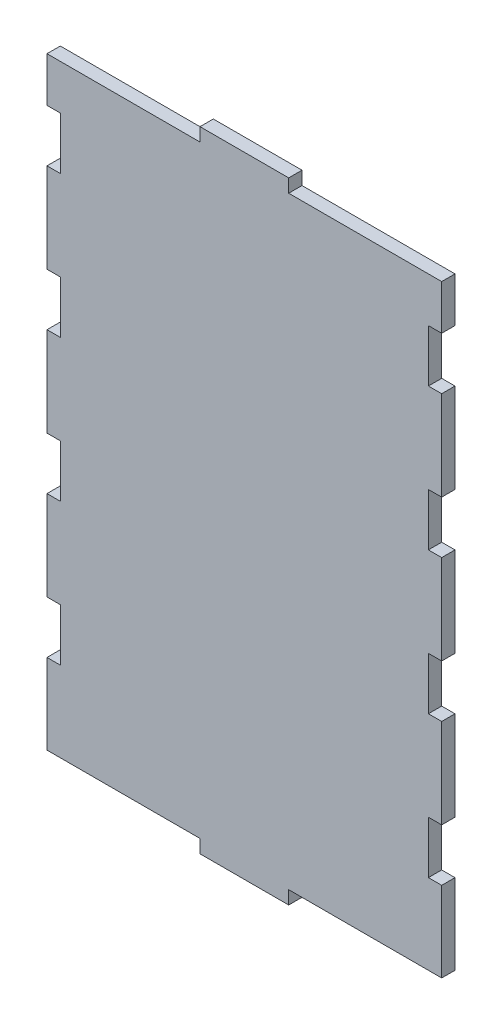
SolidWorks part; units mm, degrees
ref_plane "Alzado" through (0, 0, 0) normal (0, 0, 1) x (1, 0, 0)
ref_plane "Planta" through (0, 0, 0) normal (0, 1, 0) x (1, 0, 0)
ref_plane "Vista lateral" through (0, 0, 0) normal (1, 0, 0) x (0, 0, -1)
sketch "Croquis1" plane through (0, 0, 0) normal (0, 0, 1) x (1, 0, 0)
  line L1 (222.5, -355) -> (-222.5, -355)
  line L2 (222.5, -355) -> (222.5, 355)
  line L3 (222.5, 355) -> (-222.5, 355)
  line L4 (-222.5, -355) -> (-222.5, 355)
  line L5 (222.5, -355) -> (-222.5, 355) construction
  line L6 (222.5, 355) -> (-222.5, -355) construction
  point P0 (0, 0)
extrude "Saliente-Extruir1" add sketch "Croquis1" along normal blind 15
sketch "Croquis2" plane through (0, 0, 15) normal (0, 0, 1) x (1, 0, 0)
  line L0 (-222.5, -355) -> (-222.5, -340)
  line L1 (-222.5, 355) -> (-222.5, -355) construction
  line L2 (-222.5, -340) -> (-50, -340)
  line L3 (-50, -340) -> (-50, -355)
  line L4 (-222.5, -355) -> (222.5, -355) construction
  line L5 (-50, -355) -> (-222.5, -355)
  line L6 (50, -355) -> (50, -340)
  line L7 (50, -340) -> (222.5, -340)
  line L8 (222.5, -355) -> (222.5, 355) construction
  line L9 (222.5, -340) -> (222.5, -355)
  line L10 (222.5, -355) -> (50, -355)
  line L11 (0, 0) -> (222.5, 0) construction
  line L12 (222.5, 355) -> (50, 355)
  line L13 (222.5, 340) -> (222.5, 355)
  line L14 (50, 340) -> (222.5, 340)
  line L15 (50, 355) -> (50, 340)
  line L16 (-50, 355) -> (-222.5, 355)
  line L17 (-50, 340) -> (-50, 355)
  line L18 (-222.5, 340) -> (-50, 340)
  line L19 (-222.5, 355) -> (-222.5, 340)
extrude "Cortar-Extruir1" cut sketch "Croquis2" against normal through all
sketch "Croquis4" plane through (0, 0, 15) normal (0, 0, 1) x (1, 0, 0)
  line L0 (-222.5, -249.5) -> (-222.5, -190.5)
  line L1 (-222.5, -249.5) -> (-207.5, -249.5)
  line L2 (-222.5, -249.5) -> (-222.5, -350.5) construction
  line L5 (-207.5, 289.5) -> (-207.5, 230.5)
  line L6 (-222.5, -89.5) -> (-207.5, -89.5)
  line L7 (-222.5, -89.5) -> (-222.5, -190.5) construction
  line L8 (-222.5, -190.5) -> (-207.5, -190.5)
  line L9 (222.5, 289.5) -> (222.5, 390.5) construction
  line L10 (-207.5, 129.5) -> (-207.5, 70.5)
  line L11 (-222.5, 70.5) -> (-207.5, 70.5)
  line L12 (-222.5, 70.5) -> (-222.5, -30.5) construction
  line L13 (-222.5, -30.5) -> (-207.5, -30.5)
  line L14 (222.5, 70.5) -> (222.5, -30.5) construction
  line L15 (-222.5, 289.5) -> (-222.5, 230.5)
  line L16 (-222.5, -89.5) -> (-222.5, -30.5)
  line L17 (-222.5, 129.5) -> (-222.5, 70.5)
  line L18 (-222.5, 230.5) -> (-207.5, 230.5)
  line L19 (-222.5, 230.5) -> (-222.5, 129.5)
  line L20 (-222.5, 129.5) -> (-207.5, 129.5)
  line L21 (222.5, -89.5) -> (222.5, -190.5) construction
  line L22 (-207.5, -30.5) -> (-207.5, -89.5)
  line L23 (-222.5, 289.5) -> (-207.5, 289.5)
  line L24 (-222.5, 289.5) -> (-222.5, 390.5) construction
  line L26 (222.5, -350.5) -> (207.5, -350.5) construction
  line L27 (0, 355) -> (0, -355) construction
  line L28 (-207.5, -190.5) -> (-207.5, -249.5)
  line L29 (50, 355) -> (-50, 355) construction
  line L30 (222.5, -249.5) -> (222.5, -350.5) construction
  line L31 (207.5, -190.5) -> (207.5, -249.5)
  line L32 (222.5, 289.5) -> (207.5, 289.5)
  line L33 (207.5, -30.5) -> (207.5, -89.5)
  line L34 (222.5, 129.5) -> (207.5, 129.5)
  line L35 (222.5, 230.5) -> (222.5, 129.5)
  line L36 (222.5, 230.5) -> (207.5, 230.5)
  line L37 (222.5, 129.5) -> (222.5, 70.5)
  line L38 (222.5, -89.5) -> (222.5, -30.5)
  line L39 (222.5, 289.5) -> (222.5, 230.5)
  line L40 (222.5, -30.5) -> (207.5, -30.5)
  line L41 (222.5, 70.5) -> (207.5, 70.5)
  line L42 (207.5, 129.5) -> (207.5, 70.5)
  line L43 (222.5, -190.5) -> (207.5, -190.5)
  line L44 (222.5, -89.5) -> (207.5, -89.5)
  line L45 (207.5, 289.5) -> (207.5, 230.5)
  line L46 (222.5, -249.5) -> (207.5, -249.5)
  line L47 (222.5, -249.5) -> (222.5, -190.5)
  point P10 (0, 0)
  point P21 (-222.5, 340)
extrude "Cortar-Extruir2" cut sketch "Croquis4" against normal blind 15 contours L20 L11 L10 M64 | L22 L13 L6 M64 | L28 L8 L1 M64 | L46 L43 L31 M58 | L44 L40 L33 M58 | L34 L42 L41 M58 | L32 L45 L36 M58 | L15 L23 L5 L18
equation "\"D1@Croquis1\"=\"anchbase\" + 3 * \"thicknes\""
equation "\"profmueble\"= \"profbase\" + 200 + 2 * \"thicknes\""
equation "\"thicknes\"=15"
equation "\"profbase\"= 400"
equation "\"anchbase\"= 400"
equation "\"altura\"=150"
equation "\"clearens\"=0"
equation "\"joind1\"=100"
equation "\"Malto\"= 710"
equation "\"D2@Croquis1\"=\"Malto\""
equation "\"D1@Saliente-Extruir1\"=\"thicknes\""
equation "\"D1@Croquis2\"=\"joind1\""
equation "\"D2@Croquis2\"=\"thicknes\""
equation "\"D1@Croquis4\"=\"thicknes\""
